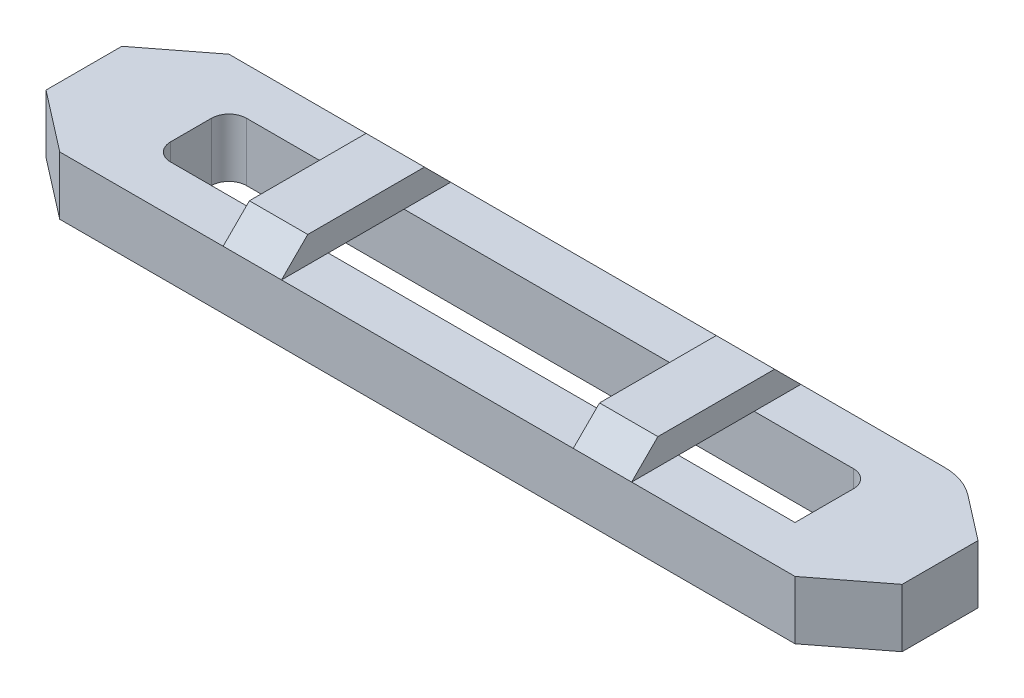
SolidWorks part; units mm, degrees
ref_plane "Alzado" through (0, 0, 0) normal (0, 0, 1) x (1, 0, 0)
ref_plane "Planta" through (0, 0, 0) normal (0, 1, 0) x (1, 0, 0)
ref_plane "Vista lateral" through (0, 0, 0) normal (1, 0, 0) x (0, 0, -1)
sketch "Croquis1" plane through (0, 0, 0) normal (0, 1, 0) x (1, 0, 0)
  line L0 (-55, 6.5) -> (55, -6.5) construction
  line L1 (-52, 6.5) -> (52, 6.5)
  line L2 (-55, 3.5) -> (-55, -3.5)
  line L3 (-52, -6.5) -> (55, -6.5)
  line L4 (55, 3.5) -> (55, -6.5)
  line L5 (-63, 14.5) -> (63, 14.5)
  line L6 (-55, 6.5) -> (-55, -6.5) construction
  line L7 (-63, -14.5) -> (63, -14.5)
  line L8 (0, 38.4134) -> (0, -37.0114) construction
  line L9 (-63, 14.5) -> (-73.356, 6.5)
  line L10 (-73.356, 6.5) -> (-73.356, -6.5)
  line L11 (63, -14.5) -> (73.356, -6.5)
  line L12 (-63, -14.5) -> (-73.356, -6.5)
  line L13 (-63, 14.5) -> (-63, -14.5) construction
  line L14 (73.356, 6.5) -> (73.356, -6.5)
  line L15 (63, 14.5) -> (73.356, 6.5)
  line L16 (63, 14.5) -> (63, -14.5) construction
  line L17 (-55, 6.5) -> (55, 6.5) construction
  line L18 (-55, -6.5) -> (55, -6.5) construction
  line L19 (55, 6.5) -> (55, -6.5) construction
  arc A0 (-55, 3.5) -> (-52, 6.5) centre (-52, 3.5) cw
  arc A1 (-55, -3.5) -> (-52, -6.5) centre (-52, -3.5) ccw
  arc A2 (55, 3.5) -> (52, 6.5) centre (52, 3.5) ccw
  point P14 (-73.356, 0)
  dimension "D4" = 3
  dimension "D1" = 110
  dimension "D2" = 8
extrude "Extruir1" add sketch "Croquis1" along normal blind 10
ref_plane "Plano1" through (30, 0, 0) normal (1, 0, 0) x (0, 0, -1)
sketch "Croquis4" plane through (30, 0, 0) normal (1, 0, 0) x (0, 0, -1)
  line L0 (-14.5, 10) -> (14.5, 10)
  line L1 (14.5, 10) -> (10, 14.5)
  line L2 (10, 14.5) -> (-10, 14.5)
  line L3 (-10, 14.5) -> (-14.5, 10)
  dimension "D1" = 45
  dimension "D2" = 45
  dimension "D3" = 20
extrude "Extruir3" add sketch "Croquis4" along normal mid plane 10
mirror "Simetría1" about plane through (0, 0, 0) normal (1, 0, 0) of "Extruir3"
fillet "Redondeo1" radius 10 1 edges at (63, 5, -14.5)
